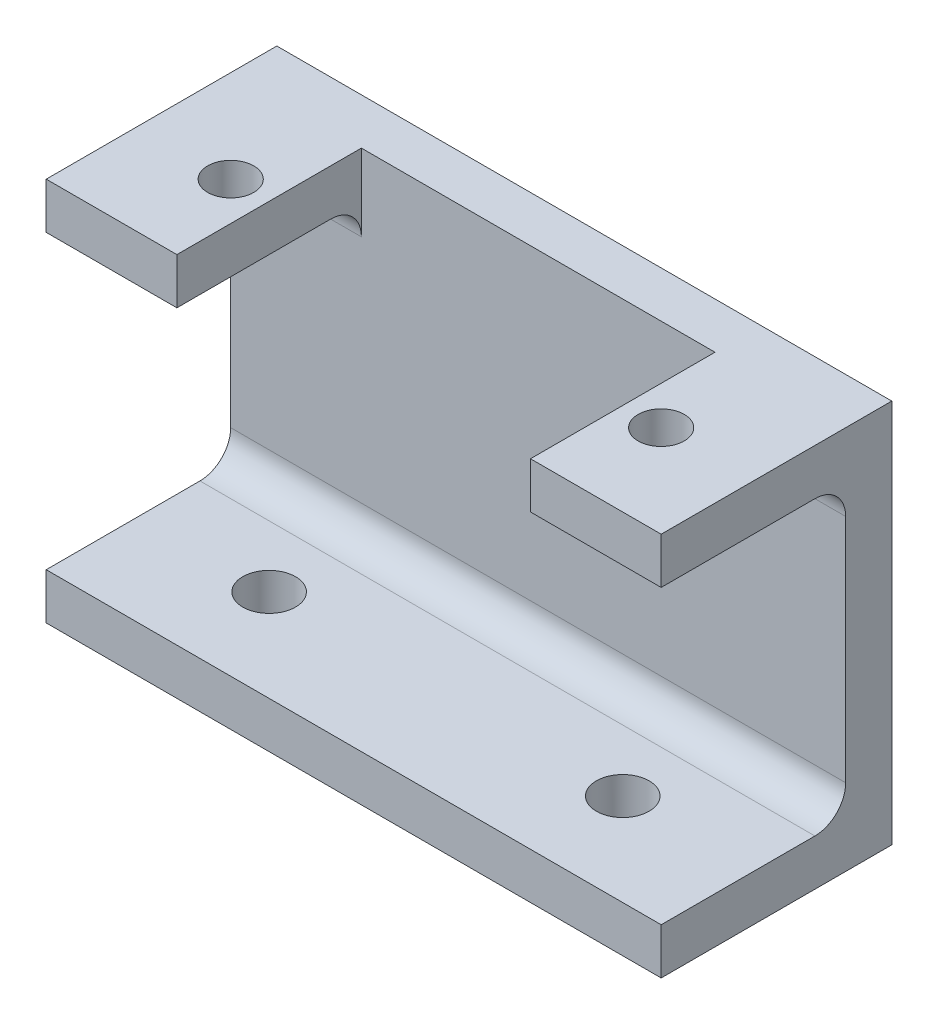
SolidWorks part; units mm, degrees
ref_plane "Plan de face" through (0, 0, 0) normal (0, 0, 1) x (1, 0, 0)
ref_plane "Plan de dessus" through (0, 0, 0) normal (0, 1, 0) x (1, 0, 0)
ref_plane "Plan de droite" through (0, 0, 0) normal (1, 0, 0) x (0, 0, -1)
sketch "Esquisse1" plane through (0, 0, 0) normal (0, 0, 1) x (1, 0, 0)
  line L1 (-19.1344, 12.574) -> (20.8656, 12.574)
  line L2 (-19.1344, 12.574) -> (-19.1344, -12.426)
  line L3 (-19.1344, -12.426) -> (20.8656, -12.426)
  line L4 (20.8656, 12.574) -> (20.8656, -12.426)
  dimension "D1" = 40
  dimension "D2" = 25
extrude "Boss.-Extru.1" add sketch "Esquisse1" along normal blind 3
sketch "Esquisse2" plane through (0, 0, 3) normal (0, 0, 1) x (1, 0, 0)
  line L0 (20.8656, -12.426) -> (20.8656, 12.574) construction
  line L1 (-19.1344, -12.426) -> (20.8656, -12.426)
  line L2 (-19.1344, -12.426) -> (-19.1344, -9.426)
  line L3 (-19.1344, -9.426) -> (20.8656, -9.426)
  line L4 (20.8656, -12.426) -> (20.8656, -9.426)
  line L6 (-19.1344, 12.574) -> (-10.6344, 12.574)
  line L7 (-19.1344, 12.574) -> (-19.1344, 9.574)
  line L8 (-19.1344, 9.574) -> (-10.6344, 9.574)
  line L9 (-10.6344, 12.574) -> (-10.6344, 9.574)
  line L10 (20.8656, 12.574) -> (12.3656, 12.574)
  line L11 (20.8656, 12.574) -> (20.8656, 9.574)
  line L12 (20.8656, 9.574) -> (12.3656, 9.574)
  line L13 (12.3656, 12.574) -> (12.3656, 9.574)
  dimension "D1" = 3
  dimension "D2" = 3
  dimension "D3" = 3
  dimension "D4" = 23
  dimension "D5" = 8.5
extrude "Boss.-Extru.2" add sketch "Esquisse2" along normal blind 12
sketch "Esquisse3" plane through (0, -9.426, 0) normal (0, 1, 0) x (1, 0, 0)
  line L0 (-10.6344, -15) -> (-10.6344, -3) construction
  line L1 (0.8656, -15) -> (0.8656, 0) construction
  line L2 (20.8656, -15) -> (-19.1344, -15) construction
  line L3 (20.8656, 0) -> (-19.1344, 0) construction
  circle A0 centre (-10.6344, -9) radius 1.7165
  circle A1 centre (12.3656, -9) radius 1.7165
  point P2 (0.8656, -15)
extrude "Enlèv. mat.-Extru.1" cut sketch "Esquisse3" against normal up to next
sketch "Esquisse4" plane through (0, 12.574, 0) normal (0, 1, 0) x (1, 0, 0)
  line L0 (0.8656, 0) -> (0.8656, -15) construction
  line L1 (20.8656, -15) -> (-19.1344, -15) construction
  line L2 (20.8656, 0) -> (-19.1344, 0) construction
  circle A0 centre (-13.1344, -9) radius 1.5
  circle A1 centre (14.8656, -9) radius 1.5
  point P9 (0, 0)
  point P10 (0, 0)
  point P13 (0.8656, 0)
  dimension "D2" = 3
  dimension "D1" = 14
  dimension "D3" = 6
extrude "Enlèv. mat.-Extru.2" cut sketch "Esquisse4" against normal up to next
fillet "Congé1" radius 2 3 edges at (0.8656, -9.426, 3) (-14.8844, 9.574, 3) (16.6156, 9.574, 3)
